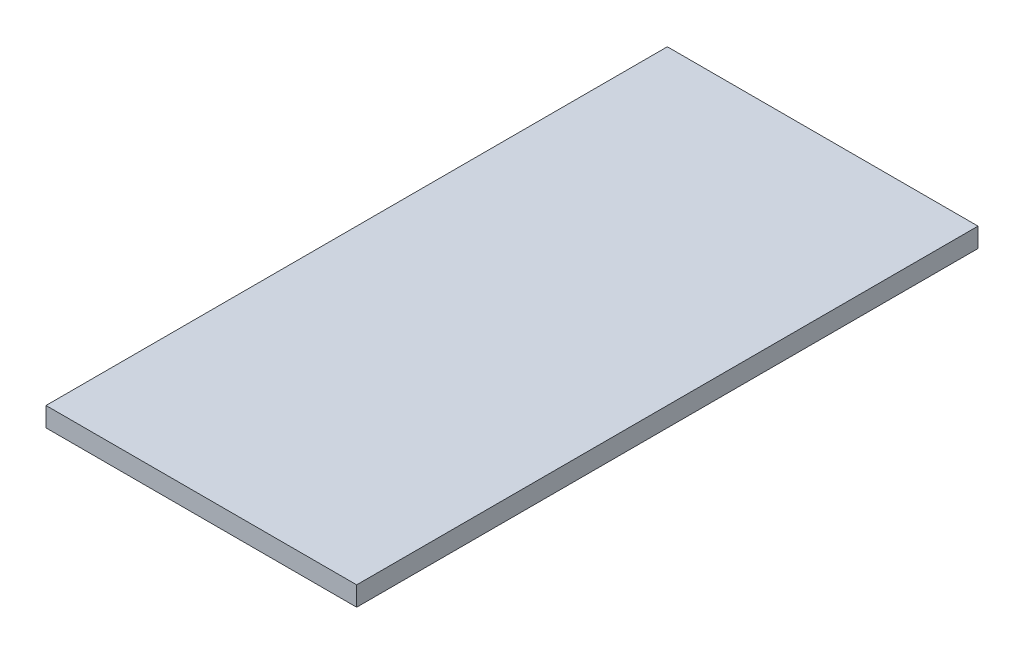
SolidWorks part; units mm, degrees
ref_plane "Front Plane" through (0, 0, 0) normal (0, 0, 1) x (1, 0, 0)
ref_plane "Top Plane" through (0, 0, 0) normal (0, 1, 0) x (1, 0, 0)
ref_plane "Right Plane" through (0, 0, 0) normal (1, 0, 0) x (0, 0, -1)
sketch "Sketch1" plane through (0, 0, 0) normal (0, 0, 1) x (1, 0, 0)
  line L1 (0, 0) -> (304.8, 0)
  line L2 (0, 0) -> (0, 19.05)
  line L3 (0, 19.05) -> (304.8, 19.05)
  line L4 (304.8, 0) -> (304.8, 19.05)
  dimension "D1" = 19.05
  dimension "D2" = 304.8
extrude "Extrude1" add sketch "Sketch1" along normal blind 609.6
